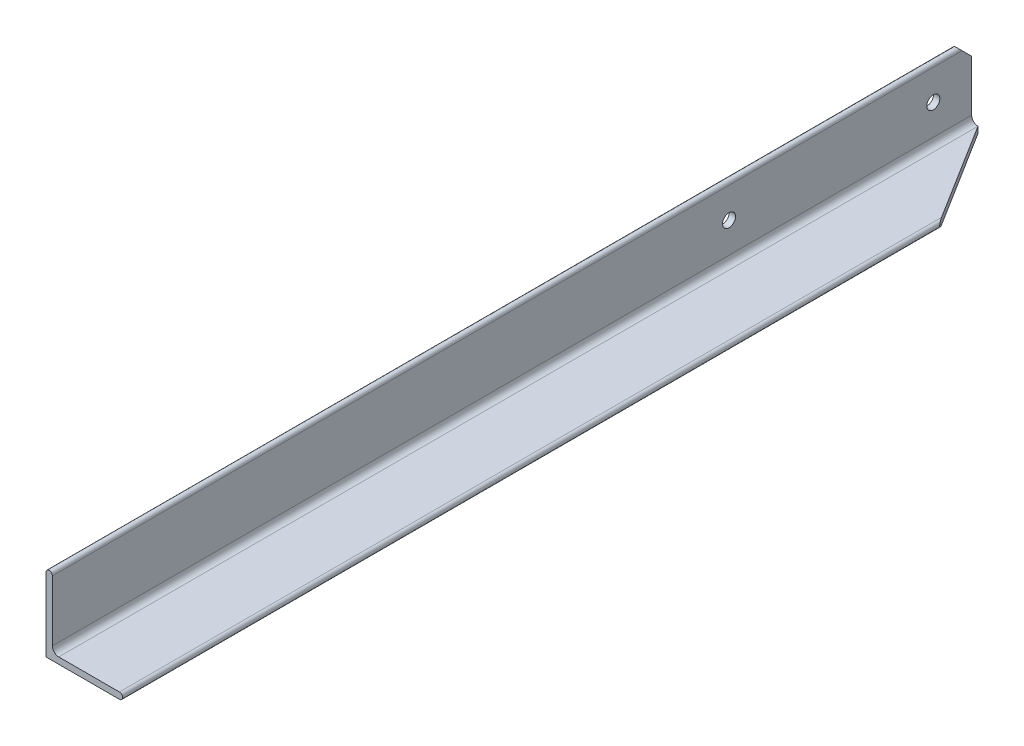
SolidWorks part; units mm, degrees
ref_plane "Front" through (0, 0, 0) normal (0, 0, 1) x (1, 0, 0)
ref_plane "Top" through (0, 0, 0) normal (0, 1, 0) x (1, 0, 0)
ref_plane "Right" through (0, 0, 0) normal (1, 0, 0) x (0, 0, -1)
sketch "Sketch1" plane through (0, 0, 0) normal (0, 0, 1) x (1, 0, 0)
  line L0 (0, 0) -> (0, 36.5125)
  line L1 (0, 0) -> (36.5125, 0)
  line L2 (6.35, 3.175) -> (36.5125, 3.175)
  line L3 (3.175, 6.35) -> (3.175, 36.5125)
  line L4 (3.175, 3.175) -> (3.175, 38.1) construction
  line L5 (3.175, 3.175) -> (38.1, 3.175) construction
  line L6 (0, 38.1) -> (3.175, 38.1) construction
  line L7 (38.1, 3.175) -> (38.1, 0) construction
  line L9 (0, 0) -> (38.1, 0) construction
  line L10 (0, 0) -> (0, 38.1) construction
  arc A0 (3.175, 6.35) -> (6.35, 3.175) centre (6.35, 6.35) ccw
  arc A1 (3.175, 36.5125) -> (0, 36.5125) centre (1.5875, 36.5125) ccw
  arc A2 (36.5125, 0) -> (36.5125, 3.175) centre (36.5125, 1.5875) ccw
  dimension "D4" = 3.175
  dimension "D1" = 38.1
  dimension "D2" = 38.1
  dimension "D3" = 3.175
extrude "Boss-Extrude1" add sketch "Sketch1" along normal mid plane 457.2
sketch "Sketch5" plane through (3.175, 0, 0) normal (1, 0, 0) x (0, 0, -1)
  line L0 (228.6, 38.1) -> (228.6, 31.75)
  line L1 (228.6, 6.35) -> (228.6, 36.5125) construction
  line L2 (228.6, 31.75) -> (222.25, 38.1)
  line L3 (228.6, 38.1) -> (-228.6, 38.1) construction
  line L4 (222.25, 38.1) -> (228.6, 38.1)
  circle A0 centre (209.55, 21.4313) radius 3.2385
  circle A1 centre (107.95, 21.4312) radius 3.2385
  dimension "D3" = 6.477
  dimension "D1" = 6.35
  dimension "D2" = 6.35
  dimension "D4" = 19.05
  dimension "D5" = 2
extrude "Cut-Extrude3" cut sketch "Sketch5" against normal through all
sketch "Sketch6" plane through (0, 3.175, 0) normal (0, 1, 0) x (1, 0, 0)
  line L0 (38.1, 228.6) -> (6.35, 228.6)
  line L1 (36.5125, 228.6) -> (6.35, 228.6) construction
  line L2 (6.35, 228.6) -> (38.1, 177.8)
  line L3 (38.1, -228.6) -> (38.1, 228.6) construction
  line L4 (38.1, 177.8) -> (38.1, 228.6)
  dimension "D1" = 31.75
  dimension "D2" = 50.8
extrude "Cut-Extrude4" cut sketch "Sketch6" against normal through all
